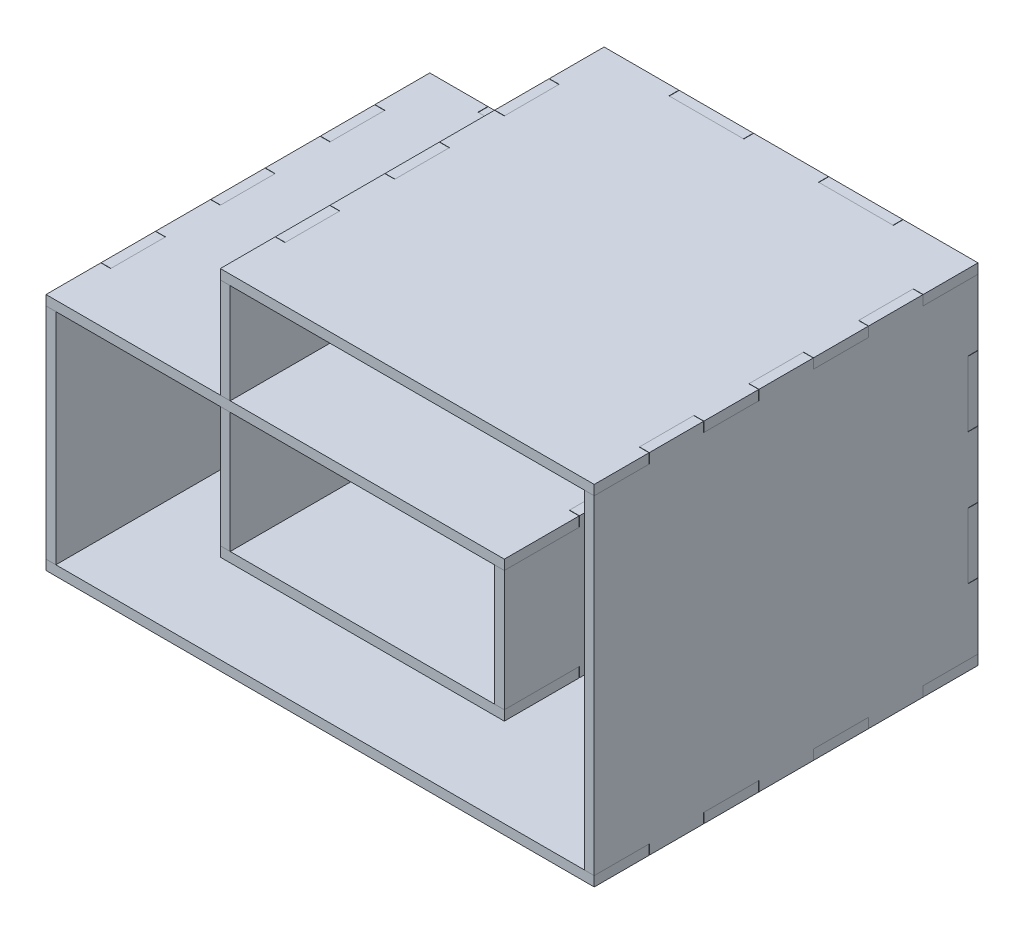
SolidWorks part; units mm, degrees
other "Exploded View1" [suppressed]
other "Explode Step1" [suppressed]
other "Explode Line1"
other "Explode Step2" [suppressed]
other "Explode Line1"
other "Explode Step3" [suppressed]
other "Explode Line1"
other "Explode Step4" [suppressed]
other "Explode Line1"
other "Explode Step5" [suppressed]
other "Explode Line1"
other "Explode Step6" [suppressed]
other "Explode Line1"
other "Explode Step7" [suppressed]
other "Explode Line1"
other "Explode Step8" [suppressed]
other "Explode Line1"
other "Explode Step9" [suppressed]
other "Explode Line1"
other "Explode Step10" [suppressed]
other "Explode Line1"
other "Explode Step11" [suppressed]
other "Explode Line1"
other "Explode Line2"
ref_plane "Front Plane" through (0, 0, 0) normal (0, 0, 1) x (1, 0, 0)
ref_plane "Top Plane" through (0, 0, 0) normal (0, 1, 0) x (1, 0, 0)
ref_plane "Right Plane" through (0, 0, 0) normal (1, 0, 0) x (0, 0, -1)
sketch "Sketch1" plane through (0, 0, 0) normal (0, 1, 0) x (1, 0, 0)
  line L1 (-500, 500) -> (500, 500)
  line L2 (-500, 500) -> (-500, -500)
  line L3 (-500, -500) -> (500, -500)
  line L4 (500, 500) -> (500, -500)
  line L5 (-500, 500) -> (500, -500) construction
  line L6 (-500, -500) -> (500, 500) construction
  point P0 (0, 0)
  dimension "D1" = 1000
extrude "Boss-Extrude1" add sketch "Sketch1" along normal blind 18
sketch "Sketch2" plane through (0, 18, 0) normal (0, 1, 0) x (1, 0, 0)
  line L0 (-500, -500) -> (500, -500) construction
  line L1 (-500, 500) -> (-482, 500)
  line L2 (-500, 500) -> (-500, -500)
  line L3 (-500, -500) -> (-482, -500)
  line L4 (-482, 500) -> (-482, -500)
  line L6 (500, 500) -> (482, 500)
  line L7 (500, 500) -> (500, -500)
  line L8 (500, -500) -> (482, -500)
  line L9 (482, 500) -> (482, -500)
extrude "Boss-Extrude2" add sketch "Sketch2" along normal blind 400 separate body
sketch "Sketch3" plane through (0, 18, 0) normal (0, 1, 0) x (1, 0, 0)
  line L0 (482, 500) -> (482, -500) construction
  line L1 (-482, 500) -> (482, 500)
  line L2 (-482, 500) -> (-482, 482)
  line L3 (-482, 482) -> (482, 482)
  line L4 (482, 500) -> (482, 482)
extrude "Boss-Extrude3" add sketch "Sketch3" along normal up to surface (400 mm away) separate body
other "Move Face1" parameters "D1"=200
sketch "Sketch4" plane through (0, 0, -482) normal (0, 0, 1) x (1, 0, 0)
  line L0 (-482, 418) -> (482, 418) construction
  line L1 (-182, 418) -> (482, 418)
  line L2 (-182, 418) -> (-182, 618)
  line L3 (-182, 618) -> (482, 618)
  line L4 (482, 418) -> (482, 618)
  line L5 (482, 618) -> (482, 18) construction
  dimension "D1" = 300
extrude "Boss-Extrude4" add sketch "Sketch4" against normal up to surface (18 mm away)
sketch "Sketch5" plane through (0, 418, 0) normal (0, 1, 0) x (1, 0, 0)
  line L0 (-500, 500) -> (-500, -500) construction
  line L1 (-500, 482) -> (482, 482)
  line L2 (-500, 482) -> (-500, -500)
  line L3 (-500, -500) -> (482, -500)
  line L4 (482, 482) -> (482, -500)
  line L5 (482, 500) -> (482, -500) construction
extrude "Boss-Extrude5" add sketch "Sketch5" along normal blind 18 separate body
sketch "Sketch6" plane through (0, 436, 0) normal (0, 1, 0) x (1, 0, 0)
  line L0 (-500, -500) -> (482, -500) construction
  line L1 (-182, 482) -> (-164, 482)
  line L2 (-182, 482) -> (-182, -500)
  line L3 (-182, -500) -> (-164, -500)
  line L4 (-164, 482) -> (-164, -500)
  line L5 (482, -500) -> (500, -500) construction
extrude "Boss-Extrude6" add sketch "Sketch6" along normal up to surface (182 mm away) separate body
sketch "Sketch7" plane through (0, 618, 0) normal (0, 1, 0) x (1, 0, 0)
  line L1 (-182, 500) -> (500, 500)
  line L2 (-182, 500) -> (-182, -500)
  line L3 (-182, -500) -> (500, -500)
  line L4 (500, 500) -> (500, -500)
extrude "Boss-Extrude7" add sketch "Sketch7" along normal blind 18 separate body
sketch "Sketch8" plane through (0, 418, 0) normal (0, -1, 0) x (1, 0, 0)
  line L1 (-182, 500) -> (-164, 500)
  line L2 (-182, 500) -> (-182, -482)
  line L3 (-182, -482) -> (-164, -482)
  line L4 (-164, 500) -> (-164, -482)
  line L5 (-164, 500) -> (-164, -482) construction
  line L6 (-500, 500) -> (482, 500) construction
  line L7 (-482, -482) -> (-182, -482) construction
extrude "Boss-Extrude8" add sketch "Sketch8" along normal blind 220 separate body
move or copy body "Body-Move/Copy1" bodies to move or copy 110 copy yes number of copies 1 translate (500, 0, 0)
sketch "Sketch9" plane through (0, 198, 0) normal (0, -1, 0) x (1, 0, 0)
  line L0 (336, -482) -> (336, 500) construction
  line L1 (-182, 500) -> (336, 500)
  line L2 (-182, 500) -> (-182, -482)
  line L3 (-182, -482) -> (336, -482)
  line L4 (336, 500) -> (336, -482)
  line L5 (318, -482) -> (336, -482) construction
extrude "Boss-Extrude9" add sketch "Sketch9" along normal blind 18 separate body
sketch "Sketch11" plane through (0, 0, 500) normal (0, 0, 1) x (1, 0, 0)
  line L1 (336, 418) -> (482, 418)
  line L2 (336, 418) -> (336, 436)
  line L3 (336, 436) -> (482, 436)
  line L4 (482, 418) -> (482, 436)
extrude "Cut-Extrude1" cut sketch "Sketch11" against normal up to surface (982 mm away)
sketch "Sketch12" plane through (0, 436, 0) normal (0, 1, 0) x (1, 0, 0)
  line L1 (-182, 482) -> (-500, 482)
  line L2 (-182, 482) -> (-182, 500)
  line L3 (-182, 500) -> (-500, 500)
  line L4 (-500, 482) -> (-500, 500)
extrude "Boss-Extrude10" add sketch "Sketch12" against normal up to surface (18 mm away)
sketch "Sketch13" plane through (0, 636, 0) normal (0, 1, 0) x (1, 0, 0)
  line L0 (-500, 500) -> (-500, -500) construction
  line L1 (-500, -200) -> (500, -200)
  line L2 (-500, -200) -> (-500, -500)
  line L3 (-500, -500) -> (500, -500)
  line L4 (500, -200) -> (500, -500)
  line L5 (500, 500) -> (-182, 500) construction
  dimension "D1" = 700
extrude "Cut-Extrude2" cut sketch "Sketch13" against normal blind 1060
sketch "Sketch14" plane through (0, 0, 0) normal (0, -1, 0) x (1, 0, 0)
  line L0 (500, 200) -> (500, -500) construction
  line L1 (500, 100) -> (482, 100)
  line L2 (500, 100) -> (500, 0)
  line L3 (500, 0) -> (482, 0)
  line L4 (482, 100) -> (482, 0)
  line L5 (482, 200) -> (482, 100) construction
  line L6 (500, -100) -> (482, -100)
  line L7 (500, -100) -> (500, -200)
  line L8 (500, -200) -> (482, -200)
  line L9 (482, -100) -> (482, -200)
  line L10 (500, -300) -> (482, -300)
  line L11 (500, -300) -> (500, -400)
  line L12 (500, -400) -> (482, -400)
  line L13 (482, -300) -> (482, -400)
  line L14 (500, 200) -> (-500, 200) construction
  line L15 (482, 0) -> (482, -100) construction
  line L16 (482, -200) -> (482, -300) construction
  line L17 (482, -400) -> (482, -500) construction
  line L18 (500, -500) -> (-500, -500) construction
  line L19 (482, -500) -> (482, 200) construction
  line L21 (0, -349.8) -> (0, 349.8) construction
  line L22 (-482, -400) -> (-482, -500) construction
  line L23 (-482, -200) -> (-482, -300) construction
  line L24 (-482, 0) -> (-482, -100) construction
  line L25 (-482, 200) -> (-482, 100) construction
  line L26 (-482, -300) -> (-482, -400)
  line L27 (-500, -400) -> (-482, -400)
  line L28 (-500, -300) -> (-500, -400)
  line L29 (-500, -300) -> (-482, -300)
  line L30 (-482, -100) -> (-482, -200)
  line L31 (-500, -200) -> (-482, -200)
  line L32 (-500, -100) -> (-500, -200)
  line L33 (-500, -100) -> (-482, -100)
  line L34 (-482, 100) -> (-482, 0)
  line L35 (-500, 0) -> (-482, 0)
  line L36 (-500, 100) -> (-500, 0)
  line L37 (-500, 100) -> (-482, 100)
extrude "Cut-Extrude3" cut sketch "Sketch14" against normal up to surface (18 mm away)
sketch "Sketch15" plane through (0, 18, 0) normal (0, -1, 0) x (1, 0, 0)
  line L0 (482, -100) -> (482, -200) construction
  line L1 (482, -100.5) -> (500, -100.5)
  line L2 (482, -100.5) -> (482, -199.5)
  line L3 (482, -199.5) -> (500, -199.5)
  line L4 (500, -100.5) -> (500, -199.5)
  line L5 (500, 200) -> (500, -500) construction
  line L6 (482, -300) -> (482, -400) construction
  line L7 (482, -300.5) -> (500, -300.5)
  line L8 (482, -300.5) -> (482, -399.5)
  line L9 (482, -399.5) -> (500, -399.5)
  line L10 (500, -300.5) -> (500, -399.5)
  line L11 (482, 100) -> (482, 0) construction
  line L12 (482, 99.5) -> (500, 99.5)
  line L13 (482, 99.5) -> (482, 0.5)
  line L14 (482, 0.5) -> (500, 0.5)
  line L15 (500, 99.5) -> (500, 0.5)
  line L16 (482, 99.5) -> (482, 100) construction
  line L17 (482, 0.5) -> (482, 0) construction
  line L18 (482, -100.5) -> (482, -100) construction
  line L19 (482, -199.5) -> (482, -200) construction
  line L20 (482, -300.5) -> (482, -300) construction
  line L21 (482, -399.5) -> (482, -400) construction
  line L22 (0, -349.8) -> (0, 349.8) construction
  line L23 (-482, -399.5) -> (-482, -400) construction
  line L24 (-482, -300.5) -> (-482, -300) construction
  line L25 (-482, -199.5) -> (-482, -200) construction
  line L26 (-482, -100.5) -> (-482, -100) construction
  line L27 (-482, 0.5) -> (-482, 0) construction
  line L28 (-482, 99.5) -> (-482, 100) construction
  line L29 (-500, 99.5) -> (-500, 0.5)
  line L30 (-482, 0.5) -> (-500, 0.5)
  line L31 (-482, 99.5) -> (-482, 0.5)
  line L32 (-482, 99.5) -> (-500, 99.5)
  line L33 (-500, -300.5) -> (-500, -399.5)
  line L34 (-482, -399.5) -> (-500, -399.5)
  line L35 (-482, -300.5) -> (-482, -399.5)
  line L36 (-482, -300.5) -> (-500, -300.5)
  line L37 (-500, -100.5) -> (-500, -199.5)
  line L38 (-482, -199.5) -> (-500, -199.5)
  line L39 (-482, -100.5) -> (-482, -199.5)
  line L40 (-482, -100.5) -> (-500, -100.5)
  dimension "D1" = 0.5
extrude "Boss-Extrude11" add sketch "Sketch15" along normal up to surface (18 mm away)
sketch "Sketch16" plane through (0, 0, 0) normal (0, -1, 0) x (1, 0, 0)
  line L0 (500, -500) -> (-500, -500) construction
  line L1 (-357.1429, -500) -> (-214.2857, -500)
  line L2 (-357.1429, -500) -> (-357.1429, -482)
  line L3 (-357.1429, -482) -> (-214.2857, -482)
  line L4 (-214.2857, -500) -> (-214.2857, -482)
  line L5 (-500, -482) -> (-357.1429, -482) construction
  line L6 (-71.4286, -500) -> (71.4286, -500)
  line L7 (-71.4286, -500) -> (-71.4286, -482)
  line L8 (-71.4286, -482) -> (71.4286, -482)
  line L9 (71.4286, -500) -> (71.4286, -482)
  line L10 (214.2857, -500) -> (357.1429, -500)
  line L11 (214.2857, -500) -> (214.2857, -482)
  line L12 (214.2857, -482) -> (357.1429, -482)
  line L13 (357.1429, -500) -> (357.1429, -482)
  line L14 (-500, -500) -> (-500, -400) construction
  line L15 (-482, -482) -> (-182, -482) construction
  line L16 (-214.2857, -482) -> (-71.4286, -482) construction
  line L17 (71.4286, -482) -> (214.2857, -482) construction
  line L18 (357.1429, -482) -> (500, -482) construction
  line L19 (500, -400) -> (500, -500) construction
extrude "Cut-Extrude4" cut sketch "Sketch16" against normal up to surface (18 mm away)
sketch "Sketch17" plane through (0, 18, 0) normal (0, -1, 0) x (1, 0, 0)
  line L0 (482, -500) -> (-482, -500) construction
  line L1 (-356.5429, -500) -> (-214.8857, -500)
  line L2 (-356.5429, -500) -> (-356.5429, -482)
  line L3 (-356.5429, -482) -> (-214.8857, -482)
  line L4 (-214.8857, -500) -> (-214.8857, -482)
  line L5 (-214.2857, -482) -> (-357.1429, -482) construction
  line L6 (71.4286, -482) -> (-71.4286, -482) construction
  line L7 (-70.8286, -500) -> (70.8286, -500)
  line L8 (-70.8286, -500) -> (-70.8286, -482)
  line L9 (-70.8286, -482) -> (70.8286, -482)
  line L10 (70.8286, -500) -> (70.8286, -482)
  line L11 (357.1429, -482) -> (214.2857, -482) construction
  line L12 (214.8857, -500) -> (356.5429, -500)
  line L13 (214.8857, -500) -> (214.8857, -482)
  line L14 (214.8857, -482) -> (356.5429, -482)
  line L15 (356.5429, -500) -> (356.5429, -482)
  line L16 (357.1429, -482) -> (356.5429, -482) construction
  line L17 (214.8857, -482) -> (214.2857, -482) construction
  line L18 (70.8286, -482) -> (71.4286, -482) construction
  line L19 (-70.8286, -482) -> (-71.4286, -482) construction
  line L20 (-356.5429, -482) -> (-357.1429, -482) construction
  line L21 (-214.8857, -482) -> (-214.2857, -482) construction
extrude "Boss-Extrude12" add sketch "Sketch17" along normal up to surface (18 mm away)
sketch "Sketch18" plane through (0, 436, 0) normal (0, 1, 0) x (1, 0, 0)
  line L28 (-482, -100) -> (-482, 0)
  line L29 (-482, 0) -> (-500, 0)
  line L30 (-500, 0) -> (-500, -100)
  line L31 (-500, -100) -> (-482, -100)
  line L32 (-482, -100) -> (-482, 0)
  line L33 (-482, 0) -> (-500, 0)
  line L34 (-500, 0) -> (-500, -100)
  line L35 (-500, -100) -> (-482, -100)
  line L36 (-500, 200) -> (-500, 100)
  line L37 (-500, 100) -> (-482, 100)
  line L38 (-482, 100) -> (-482, 200)
  line L39 (-482, 200) -> (-500, 200)
  line L40 (-500, 200) -> (-500, 100)
  line L41 (-500, 100) -> (-482, 100)
  line L42 (-482, 100) -> (-482, 200)
  line L43 (-482, 200) -> (-500, 200)
  line L44 (-500, 400) -> (-500, 300)
  line L45 (-500, 300) -> (-482, 300)
  line L46 (-482, 300) -> (-482, 400)
  line L47 (-482, 400) -> (-500, 400)
  line L48 (-500, 400) -> (-500, 300)
  line L49 (-500, 300) -> (-482, 300)
  line L50 (-482, 300) -> (-482, 400)
  line L51 (-482, 400) -> (-500, 400)
  dimension "D4" = 0
  dimension "D5" = 0
  dimension "D6" = 0
extrude "Cut-Extrude5" cut sketch "Sketch18" against normal up to surface (18 mm away)
sketch "Sketch19" plane through (0, 418, 0) normal (0, 1, 0) x (1, 0, 0)
  line L28 (-500, -0.5) -> (-500, -99.5)
  line L29 (-482, -0.5) -> (-500, -0.5)
  line L30 (-482, -99.5) -> (-482, -0.5)
  line L31 (-500, -99.5) -> (-482, -99.5)
  line L32 (-500, -0.5) -> (-500, -99.5)
  line L33 (-482, -0.5) -> (-500, -0.5)
  line L34 (-482, -99.5) -> (-482, -0.5)
  line L35 (-500, -99.5) -> (-482, -99.5)
  line L36 (-500, 199.5) -> (-500, 100.5)
  line L37 (-482, 199.5) -> (-500, 199.5)
  line L38 (-482, 100.5) -> (-482, 199.5)
  line L39 (-500, 100.5) -> (-482, 100.5)
  line L40 (-500, 199.5) -> (-500, 100.5)
  line L41 (-482, 199.5) -> (-500, 199.5)
  line L42 (-482, 100.5) -> (-482, 199.5)
  line L43 (-500, 100.5) -> (-482, 100.5)
  line L44 (-500, 399.5) -> (-500, 300.5)
  line L45 (-482, 399.5) -> (-500, 399.5)
  line L46 (-482, 300.5) -> (-482, 399.5)
  line L47 (-500, 300.5) -> (-482, 300.5)
  line L48 (-500, 399.5) -> (-500, 300.5)
  line L49 (-482, 399.5) -> (-500, 399.5)
  line L50 (-482, 300.5) -> (-482, 399.5)
  line L51 (-500, 300.5) -> (-482, 300.5)
  dimension "D4" = 0
  dimension "D5" = 0
  dimension "D6" = 0
extrude "Boss-Extrude13" add sketch "Sketch19" along normal up to surface (18 mm away)
sketch "Sketch20" plane through (0, 636, 0) normal (0, 1, 0) x (1, 0, 0)
  line L4 (482, 300) -> (500, 300)
  line L5 (482, 400) -> (482, 300)
  line L6 (500, 400) -> (482, 400)
  line L7 (500, 300) -> (500, 400)
  line L8 (482, 300) -> (500, 300)
  line L9 (482, 400) -> (482, 300)
  line L10 (500, 400) -> (482, 400)
  line L11 (500, 300) -> (500, 400)
  line L12 (482, 100) -> (500, 100)
  line L13 (482, 200) -> (482, 100)
  line L14 (500, 200) -> (482, 200)
  line L15 (500, 100) -> (500, 200)
  line L16 (482, 100) -> (500, 100)
  line L17 (482, 200) -> (482, 100)
  line L18 (500, 200) -> (482, 200)
  line L19 (500, 100) -> (500, 200)
  line L20 (482, -100) -> (500, -100)
  line L21 (482, 0) -> (482, -100)
  line L22 (500, 0) -> (482, 0)
  line L23 (500, -100) -> (500, 0)
  line L24 (482, -100) -> (500, -100)
  line L25 (482, 0) -> (482, -100)
  line L26 (500, 0) -> (482, 0)
  line L27 (500, -100) -> (500, 0)
  dimension "D1" = 0
  dimension "D2" = 0
  dimension "D3" = 0
extrude "Cut-Extrude6" cut sketch "Sketch20" against normal up to surface (18 mm away)
sketch "Sketch21" plane through (0, 618, 0) normal (0, 1, 0) x (1, 0, 0)
  line L4 (482, 300.5) -> (500, 300.5)
  line L5 (500, 300.5) -> (500, 399.5)
  line L6 (500, 399.5) -> (482, 399.5)
  line L7 (482, 399.5) -> (482, 300.5)
  line L8 (482, 300.5) -> (500, 300.5)
  line L9 (500, 300.5) -> (500, 399.5)
  line L10 (500, 399.5) -> (482, 399.5)
  line L11 (482, 399.5) -> (482, 300.5)
  line L12 (482, 100.5) -> (500, 100.5)
  line L13 (500, 100.5) -> (500, 199.5)
  line L14 (500, 199.5) -> (482, 199.5)
  line L15 (482, 199.5) -> (482, 100.5)
  line L16 (482, 100.5) -> (500, 100.5)
  line L17 (500, 100.5) -> (500, 199.5)
  line L18 (500, 199.5) -> (482, 199.5)
  line L19 (482, 199.5) -> (482, 100.5)
  line L20 (482, -99.5) -> (500, -99.5)
  line L21 (482, -0.5) -> (482, -99.5)
  line L22 (500, -0.5) -> (482, -0.5)
  line L23 (500, -99.5) -> (500, -0.5)
  line L24 (482, -99.5) -> (500, -99.5)
  line L25 (482, -0.5) -> (482, -99.5)
  line L26 (500, -0.5) -> (482, -0.5)
  line L27 (500, -99.5) -> (500, -0.5)
  dimension "D1" = 0
  dimension "D2" = 0
  dimension "D3" = 0
extrude "Boss-Extrude14" add sketch "Sketch21" along normal up to surface (18 mm away)
sketch "Sketch22" plane through (0, 636, 0) normal (0, 1, 0) x (1, 0, 0)
  line L0 (500, 500) -> (-182, 500) construction
  line L1 (-45.6, 500) -> (90.8, 500)
  line L2 (-45.6, 500) -> (-45.6, 482)
  line L3 (-45.6, 482) -> (90.8, 482)
  line L4 (90.8, 500) -> (90.8, 482)
  line L5 (-182, 482) -> (-45.6, 482) construction
  line L6 (227.2, 500) -> (363.6, 500)
  line L7 (227.2, 500) -> (227.2, 482)
  line L8 (227.2, 482) -> (363.6, 482)
  line L9 (363.6, 500) -> (363.6, 482)
  line L10 (-182, 482) -> (-182, -200) construction
  line L11 (90.8, 482) -> (227.2, 482) construction
  line L12 (363.6, 482) -> (500, 482) construction
  line L13 (500, 400) -> (500, 500) construction
  line L14 (-482, 482) -> (-182, 482) construction
extrude "Cut-Extrude7" cut sketch "Sketch22" against normal up to surface (18 mm away)
sketch "Sketch23" plane through (0, 618, 0) normal (0, 1, 0) x (1, 0, 0)
  line L0 (-182, 500) -> (482, 500) construction
  line L1 (-45, 500) -> (90.2, 500)
  line L2 (-45, 500) -> (-45, 482)
  line L3 (-45, 482) -> (90.2, 482)
  line L4 (90.2, 500) -> (90.2, 482)
  line L5 (-45.6, 482) -> (90.8, 482) construction
  line L6 (227.2, 482) -> (363.6, 482) construction
  line L7 (227.8, 500) -> (363, 500)
  line L8 (227.8, 500) -> (227.8, 482)
  line L9 (227.8, 482) -> (363, 482)
  line L10 (363, 500) -> (363, 482)
  line L11 (-45.6, 500) -> (-45, 500) construction
  line L12 (90.2, 500) -> (90.8, 500) construction
  line L13 (227.2, 500) -> (227.8, 500) construction
  line L14 (363, 500) -> (363.6, 500) construction
extrude "Boss-Extrude15" add sketch "Sketch23" along normal up to surface (18 mm away)
sketch "Sketch24" plane through (0, 436, 0) normal (0, 1, 0) x (1, 0, 0)
  line L0 (-182, 500) -> (-500, 500) construction
  line L1 (-394, 500) -> (-288, 500)
  line L2 (-394, 500) -> (-394, 482)
  line L3 (-394, 482) -> (-288, 482)
  line L4 (-288, 500) -> (-288, 482)
  line L5 (-500, 482) -> (-394, 482) construction
  line L6 (-500, 500) -> (-500, 400) construction
  line L7 (-288, 482) -> (-182, 482) construction
  line L8 (-182, 500) -> (-182, -200) construction
  line L9 (-482, 482) -> (-182, 482) construction
extrude "Cut-Extrude8" cut sketch "Sketch24" against normal up to surface (18 mm away)
sketch "Sketch25" plane through (0, 418, 0) normal (0, 1, 0) x (1, 0, 0)
  line L0 (-182, 500) -> (-482, 500) construction
  line L1 (-393.4, 500) -> (-288.6, 500)
  line L2 (-393.4, 500) -> (-393.4, 482)
  line L3 (-393.4, 482) -> (-288.6, 482)
  line L4 (-288.6, 500) -> (-288.6, 482)
  line L5 (-394, 482) -> (-288, 482) construction
  line L6 (-394, 500) -> (-393.4, 500) construction
  line L7 (-288.6, 500) -> (-288, 500) construction
extrude "Boss-Extrude16" add sketch "Sketch25" along normal up to surface (18 mm away)
sketch "Sketch26" plane through (0, 636, 0) normal (0, 1, 0) x (1, 0, 0)
  line L5 (159, -200) -> (159, 333.8667) construction
  line L6 (500, -200) -> (-182, -200) construction
  line L7 (-164, 400) -> (-164, 300)
  line L8 (-182, 400) -> (-164, 400)
  line L9 (482, -100) -> (500, -100)
  line L10 (500, -100) -> (500, 0)
  line L11 (500, 0) -> (482, 0)
  line L12 (482, 0) -> (482, -100)
  line L13 (482, -100) -> (500, -100) construction
  line L14 (500, -100) -> (500, 0) construction
  line L15 (500, 0) -> (482, 0) construction
  line L16 (482, 0) -> (482, -100) construction
  line L17 (482, 100) -> (500, 100)
  line L18 (500, 100) -> (500, 200)
  line L19 (500, 200) -> (482, 200)
  line L20 (482, 200) -> (482, 100)
  line L21 (482, 100) -> (500, 100) construction
  line L22 (500, 100) -> (500, 200) construction
  line L23 (500, 200) -> (482, 200) construction
  line L24 (482, 200) -> (482, 100) construction
  line L25 (482, 300) -> (500, 300)
  line L26 (500, 300) -> (500, 400)
  line L27 (500, 400) -> (482, 400)
  line L28 (482, 400) -> (482, 300)
  line L29 (482, 300) -> (500, 300) construction
  line L30 (500, 300) -> (500, 400) construction
  line L31 (500, 400) -> (482, 400) construction
  line L32 (482, 400) -> (482, 300) construction
  line L33 (-182, 300) -> (-182, 400)
  line L34 (-164, 300) -> (-182, 300)
  line L35 (-164, 200) -> (-164, 100)
  line L36 (-182, 200) -> (-164, 200)
  line L37 (-182, 100) -> (-182, 200)
  line L38 (-164, 100) -> (-182, 100)
  line L39 (-164, 0) -> (-164, -100)
  line L40 (-182, 0) -> (-164, 0)
  line L41 (-182, -100) -> (-182, 0)
  line L42 (-164, -100) -> (-182, -100)
  dimension "D1" = 0
  dimension "D2" = 0
  dimension "D3" = 0
extrude "Cut-Extrude9" cut sketch "Sketch26" against normal up to surface (18 mm away)
sketch "Sketch27" plane through (0, 618, 0) normal (0, 1, 0) x (1, 0, 0)
  line L0 (159, -200) -> (159, 214.59) construction
  line L1 (500, -200) -> (-182, -200) construction
  line L2 (-164, 399.5) -> (-164, 300.5)
  line L3 (-182, 399.5) -> (-164, 399.5)
  line L4 (482, -99.5) -> (500, -99.5)
  line L5 (500, -99.5) -> (500, -0.5)
  line L6 (500, -0.5) -> (482, -0.5)
  line L7 (482, -0.5) -> (482, -99.5)
  line L8 (482, -99.5) -> (500, -99.5) construction
  line L9 (500, -99.5) -> (500, -0.5) construction
  line L10 (500, -0.5) -> (482, -0.5) construction
  line L11 (482, -0.5) -> (482, -99.5) construction
  line L12 (482, 100.5) -> (500, 100.5)
  line L13 (500, 100.5) -> (500, 199.5)
  line L14 (500, 199.5) -> (482, 199.5)
  line L15 (482, 199.5) -> (482, 100.5)
  line L16 (482, 100.5) -> (500, 100.5) construction
  line L17 (500, 100.5) -> (500, 199.5) construction
  line L18 (500, 199.5) -> (482, 199.5) construction
  line L19 (482, 199.5) -> (482, 100.5) construction
  line L20 (482, 300.5) -> (500, 300.5)
  line L21 (500, 300.5) -> (500, 399.5)
  line L22 (500, 399.5) -> (482, 399.5)
  line L23 (482, 399.5) -> (482, 300.5)
  line L24 (482, 300.5) -> (500, 300.5) construction
  line L25 (500, 300.5) -> (500, 399.5) construction
  line L26 (500, 399.5) -> (482, 399.5) construction
  line L27 (482, 399.5) -> (482, 300.5) construction
  line L28 (-182, 300.5) -> (-182, 399.5)
  line L29 (-164, 300.5) -> (-182, 300.5)
  line L30 (-164, 199.5) -> (-164, 100.5)
  line L31 (-182, 199.5) -> (-164, 199.5)
  line L32 (-182, 100.5) -> (-182, 199.5)
  line L33 (-164, 100.5) -> (-182, 100.5)
  line L34 (-164, -0.5) -> (-164, -99.5)
  line L35 (-182, -0.5) -> (-164, -0.5)
  line L36 (-182, -99.5) -> (-182, -0.5)
  line L37 (-164, -99.5) -> (-182, -99.5)
  dimension "D1" = 0
  dimension "D2" = 0
  dimension "D3" = 0
extrude "Boss-Extrude17" add sketch "Sketch27" along normal up to surface (18 mm away)
sketch "Sketch28" plane through (0, 436, 0) normal (0, 1, 0) x (1, 0, 0)
  line L0 (336, 482) -> (336, -200) construction
  line L1 (336, 345.6) -> (318, 345.6)
  line L2 (336, 345.6) -> (336, 209.2)
  line L3 (336, 209.2) -> (318, 209.2)
  line L4 (318, 345.6) -> (318, 209.2)
  line L5 (318, 482) -> (318, 345.6) construction
  line L6 (336, 72.8) -> (318, 72.8)
  line L7 (336, 72.8) -> (336, -63.6)
  line L8 (336, -63.6) -> (318, -63.6)
  line L9 (318, 72.8) -> (318, -63.6)
  line L10 (336, 482) -> (-182, 482) construction
  line L11 (318, 209.2) -> (318, 72.8) construction
  line L12 (318, -63.6) -> (318, -200) construction
  line L13 (336, -200) -> (-500, -200) construction
  line L14 (318, -200) -> (318, 482) construction
  line L15 (-164, -99.5) -> (318, -99.5) construction
  line L16 (77, -99.5) -> (77, 269.3823) construction
  line L17 (-164, 209.2) -> (-164, 72.8) construction
  line L18 (-164, 72.8) -> (-164, -63.6)
  line L19 (-182, -63.6) -> (-164, -63.6)
  line L20 (-182, 72.8) -> (-182, -63.6)
  line L21 (-182, 72.8) -> (-164, 72.8)
  line L22 (-164, 345.6) -> (-164, 209.2)
  line L23 (-182, 209.2) -> (-164, 209.2)
  line L24 (-182, 345.6) -> (-182, 209.2)
  line L25 (-182, 345.6) -> (-164, 345.6)
extrude "Cut-Extrude10" cut sketch "Sketch28" against normal up to surface (256 mm away)
sketch "Sketch29" plane through (0, 418, 0) normal (0, 1, 0) x (1, 0, 0)
  line L0 (318, -200) -> (318, 482) construction
  line L1 (318, 345) -> (336, 345)
  line L2 (318, 345) -> (318, 209.8)
  line L3 (318, 209.8) -> (336, 209.8)
  line L4 (336, 345) -> (336, 209.8)
  line L5 (336, 482) -> (336, -200) construction
  line L6 (318, 72.8) -> (318, 72.2) construction
  line L7 (318, 72.2) -> (336, 72.2)
  line L8 (318, 72.2) -> (318, -63)
  line L9 (318, -63) -> (336, -63)
  line L10 (336, 72.2) -> (336, -63)
  line L11 (318, -63) -> (318, -63.6) construction
  line L12 (318, 209.8) -> (318, 209.2) construction
  line L13 (318, 345) -> (318, 345.6) construction
  line L14 (-164, -149.75) -> (318, -149.75) construction
  line L15 (-164, -200) -> (-164, -99.5) construction
  line L17 (77, -149.75) -> (77, 188.4861) construction
  line L18 (-164, 345) -> (-164, 345.6) construction
  line L19 (-164, 209.8) -> (-164, 209.2) construction
  line L20 (-164, -63) -> (-164, -63.6) construction
  line L21 (-164, 72.8) -> (-164, 72.2) construction
  line L22 (-182, 72.2) -> (-182, -63)
  line L23 (-164, -63) -> (-182, -63)
  line L24 (-164, 72.2) -> (-164, -63)
  line L25 (-164, 72.2) -> (-182, 72.2)
  line L26 (-182, 345) -> (-182, 209.8)
  line L27 (-164, 209.8) -> (-182, 209.8)
  line L28 (-164, 345) -> (-164, 209.8)
  line L29 (-164, 345) -> (-182, 345)
extrude "Boss-Extrude18" add sketch "Sketch29" along normal up to surface and the other way up to surface
sketch "Sketch30" plane through (0, 0, -500) normal (0, 0, -1) x (-1, 0, 0)
  line L0 (182, 418) -> (182, 618) construction
  line L1 (182, 551.3333) -> (164, 551.3333)
  line L2 (182, 551.3333) -> (182, 484.6667)
  line L3 (182, 484.6667) -> (164, 484.6667)
  line L4 (164, 551.3333) -> (164, 484.6667)
  line L5 (182, 418) -> (164, 418) construction
  line L6 (164, 418) -> (164, 484.6667) construction
  line L7 (164, 551.3333) -> (164, 618) construction
  line L8 (182, 618) -> (45, 618) construction
  line L9 (164, 618) -> (182, 618) construction
extrude "Cut-Extrude12" cut sketch "Sketch30" against normal up to surface (18 mm away)
sketch "Sketch31" plane through (0, 0, -482) normal (0, 0, -1) x (-1, 0, 0)
  line L0 (164, 484.6667) -> (164, 551.3333) construction
  line L1 (164, 550.7333) -> (182, 550.7333)
  line L2 (164, 550.7333) -> (164, 485.2667)
  line L3 (164, 485.2667) -> (182, 485.2667)
  line L4 (182, 550.7333) -> (182, 485.2667)
  line L5 (182, 618) -> (182, 436) construction
  line L6 (164, 484.6667) -> (164, 485.2667) construction
  line L7 (164, 550.7333) -> (164, 551.3333) construction
extrude "Boss-Extrude19" add sketch "Sketch31" along normal up to surface (18 mm away)
sketch "Sketch32" plane through (500, 0, 0) normal (1, 0, 0) x (0, 0, -1)
  line L0 (500, 618) -> (500, 18) construction
  line L1 (500, 498) -> (482, 498)
  line L2 (500, 498) -> (500, 378)
  line L3 (500, 378) -> (482, 378)
  line L4 (482, 498) -> (482, 378)
  line L5 (482, 618) -> (482, 498) construction
  line L6 (500, 258) -> (482, 258)
  line L7 (500, 258) -> (500, 138)
  line L8 (500, 138) -> (482, 138)
  line L9 (482, 258) -> (482, 138)
  line L10 (400, 618) -> (500, 618) construction
  line L11 (482, 378) -> (482, 258) construction
  line L12 (482, 138) -> (482, 18) construction
  line L13 (400, 18) -> (500, 18) construction
  line L14 (482, 484.6667) -> (482, 551.3333) construction
extrude "Cut-Extrude13" cut sketch "Sketch32" against normal up to surface (18 mm away)
sketch "Sketch33" plane through (482, 0, 0) normal (1, 0, 0) x (0, 0, -1)
  line L0 (500, 618) -> (500, 18) construction
  line L1 (500, 138.6) -> (482, 138.6)
  line L2 (500, 138.6) -> (500, 257.4)
  line L3 (500, 257.4) -> (482, 257.4)
  line L4 (482, 138.6) -> (482, 257.4)
  line L5 (482, 258) -> (482, 138) construction
  line L6 (482, 378) -> (482, 498) construction
  line L7 (500, 378.6) -> (482, 378.6)
  line L8 (500, 378.6) -> (500, 497.4)
  line L9 (500, 497.4) -> (482, 497.4)
  line L10 (482, 378.6) -> (482, 497.4)
  line L11 (482, 138.6) -> (482, 138) construction
  line L12 (482, 257.4) -> (482, 258) construction
  line L13 (482, 378.6) -> (482, 378) construction
  line L14 (482, 497.4) -> (482, 498) construction
extrude "Boss-Extrude20" add sketch "Sketch33" along normal up to surface (18 mm away)
sketch "Sketch34" plane through (-500, 0, 0) normal (-1, 0, 0) x (0, 0, 1)
  line L0 (-500, 418) -> (-500, 18) construction
  line L1 (-500, 284.6667) -> (-482, 284.6667)
  line L2 (-500, 284.6667) -> (-500, 151.3333)
  line L3 (-500, 151.3333) -> (-482, 151.3333)
  line L4 (-482, 284.6667) -> (-482, 151.3333)
  line L5 (-482, 284.6667) -> (-482, 418) construction
  line L6 (-500, 418) -> (-399.5, 418) construction
  line L7 (-482, 151.3333) -> (-482, 18) construction
  line L8 (-500, 18) -> (-400, 18) construction
  line L9 (-482, 484.6667) -> (-482, 551.3333) construction
extrude "Cut-Extrude14" cut sketch "Sketch34" against normal up to surface (18 mm away)
sketch "Sketch35" plane through (-482, 0, 0) normal (-1, 0, 0) x (0, 0, 1)
  line L0 (-500, 418) -> (-500, 18) construction
  line L1 (-500, 284.0667) -> (-482, 284.0667)
  line L2 (-500, 284.0667) -> (-500, 151.9333)
  line L3 (-500, 151.9333) -> (-482, 151.9333)
  line L4 (-482, 284.0667) -> (-482, 151.9333)
  line L5 (-482, 284.6667) -> (-482, 151.3333) construction
  line L6 (-500, 151.3333) -> (-500, 151.9333) construction
  line L7 (-500, 284.0667) -> (-500, 284.6667) construction
extrude "Boss-Extrude21" add sketch "Sketch35" along normal up to surface (18 mm away)
sketch "Sketch36" plane through (0, 436, 0) normal (0, 1, 0) x (1, 0, 0)
  line L0 (-182, 500) -> (-288, 500) construction
  line L1 (-182.6, 500) -> (-182, 500)
  line L2 (-182.6, 500) -> (-182.6, 481.4)
  line L3 (-182.6, 481.4) -> (-182, 481.4)
  line L4 (-182, 500) -> (-182, 481.4)
  line L5 (-182, 482) -> (-182, -200) construction
  line L6 (-182, 482) -> (-182, 481.4) construction
extrude "Cut-Extrude15" cut sketch "Sketch36" against normal up to vertex
move or copy body "Body-Move/Copy2" [suppressed] bodies to move or copy 137 copy no translate (0, 352.5795, 0)
move or copy body "Body-Move/Copy3" [suppressed] bodies to move or copy 148 copy no translate (0, 0, -536.7803)
move or copy body "Body-Move/Copy4" [suppressed] bodies to move or copy 144 copy no translate (0, 281.7314, 0)
move or copy body "Body-Move/Copy5" [suppressed] bodies to move or copy 140 copy no translate (0, 238.2129, 0)
move or copy body "Body-Move/Copy6" [suppressed] bodies to move or copy 152 copy no translate (0, 0, 848.5695)
move or copy body "Body-Move/Copy7" [suppressed] bodies to move or copy 147 copy no translate (-404.7478, 0, 0)
move or copy body "Body-Move/Copy8" [suppressed] bodies to move or copy 145 copy no translate (648.8485, 0, 0)
move or copy body "Body-Move/Copy9" [suppressed] bodies to move or copy 142 copy no translate (429.642, 0, 0)
move or copy body "Body-Move/Copy10" [suppressed] bodies to move or copy 141 copy no translate (-247.3696, 0, 0)
move or copy body "Body-Move/Copy11" [suppressed] bodies to move or copy 139 copy no translate (0, 359.0146, 0)
move or copy body "Body-Move/Copy12" [suppressed] bodies to move or copy 153 copy no translate (0, -92.4417, 0)
move or copy body "Body-Move/Copy13" [suppressed] bodies to move or copy 127 copy no translate (0, -92.4417, 0)
equation "\"Th\"= 18"
equation "\"D1@Boss-Extrude1\"=\"Th\""
equation "\"D1@Sketch2\"=\"Th\""
equation "\"D1@Sketch3\"=\"Th\""
equation "\"D1@Boss-Extrude5\"=\"Th\""
equation "\"D1@Boss-Extrude7\"=\"Th\""
equation "\"D1@Boss-Extrude9\"=\"Th\""
equation "\"Clr\"= 0.6"
equation "\"D1@Sketch17\"=\"Clr\""
equation "\"D1@Sketch23\"=\"Clr\""
equation "\"D1@Sketch25\"=\"Clr\""
equation "\"D1@Sketch29\"=\"Clr\""
equation "\"D1@Sketch31\"=\"Clr\""
equation "\"D1@Sketch33\"=\"Clr\""
equation "\"D1@Sketch35\"=\"Clr\""
equation "\"D1@Sketch36\"=\"Clr\""
equation "\"D2@Sketch36\"=\"Clr\""
